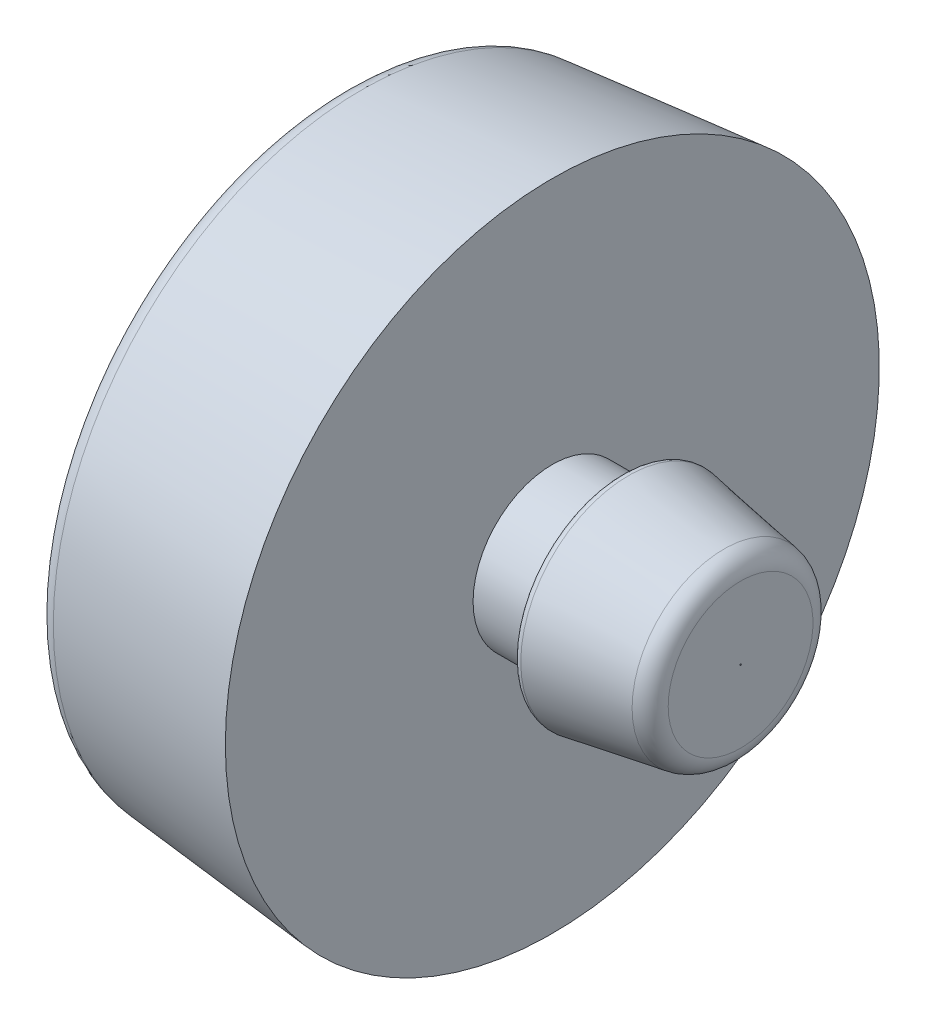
SolidWorks part; units mm, degrees
ref_plane "Face" through (0, 0, 0) normal (0, 0, 1) x (1, 0, 0)
ref_plane "Dessus" through (0, 0, 0) normal (0, 1, 0) x (1, 0, 0)
ref_plane "Droite" through (0, 0, 0) normal (1, 0, 0) x (0, 0, -1)
sketch "Esquisse1" plane through (0, 0, 0) normal (0, 0, 1) x (1, 0, 0)
  line L0 (-8.5585, 0) -> (23.5793, 0) construction
  line L1 (0, 0.0349) -> (0, 14.5907)
  line L2 (10.5, 16.5) -> (0.9052, 15.5862)
  line L3 (10.5, 16.5) -> (10.5, 4)
  line L4 (10.5, 4) -> (14, 4)
  line L5 (14, 4) -> (14, 5.1459)
  line L6 (20, 0.0349) -> (20, 3.6529)
  line L7 (14.3493, 5.4418) -> (19.1644, 4.6393)
  line L8 (20, 0.0349) -> (0, 0.0349)
  arc A0 (0.9052, 15.5862) -> (0, 14.5907) centre (1, 14.5907) ccw
  arc A1 (20, 3.6529) -> (19.1644, 4.6393) centre (19, 3.6529) ccw
  arc A2 (14.3493, 5.4418) -> (14, 5.1459) centre (14.3, 5.1459) ccw
  point P7 (0, 15.5)
  point P16 (20, 4.5)
  point P19 (14, 5.5)
  dimension "D9" = 1
  dimension "D10" = 1
  dimension "D11" = 0.3
  dimension "D1" = 15.5
  dimension "D2" = 20
  dimension "D3" = 10.5
  dimension "D4" = 3.5
  dimension "D5" = 16.5
  dimension "D6" = 4
  dimension "D7" = 5.5
  dimension "D8" = 4.5
revolve "Révolution1" add sketch "Esquisse1" angle 360 about L0
